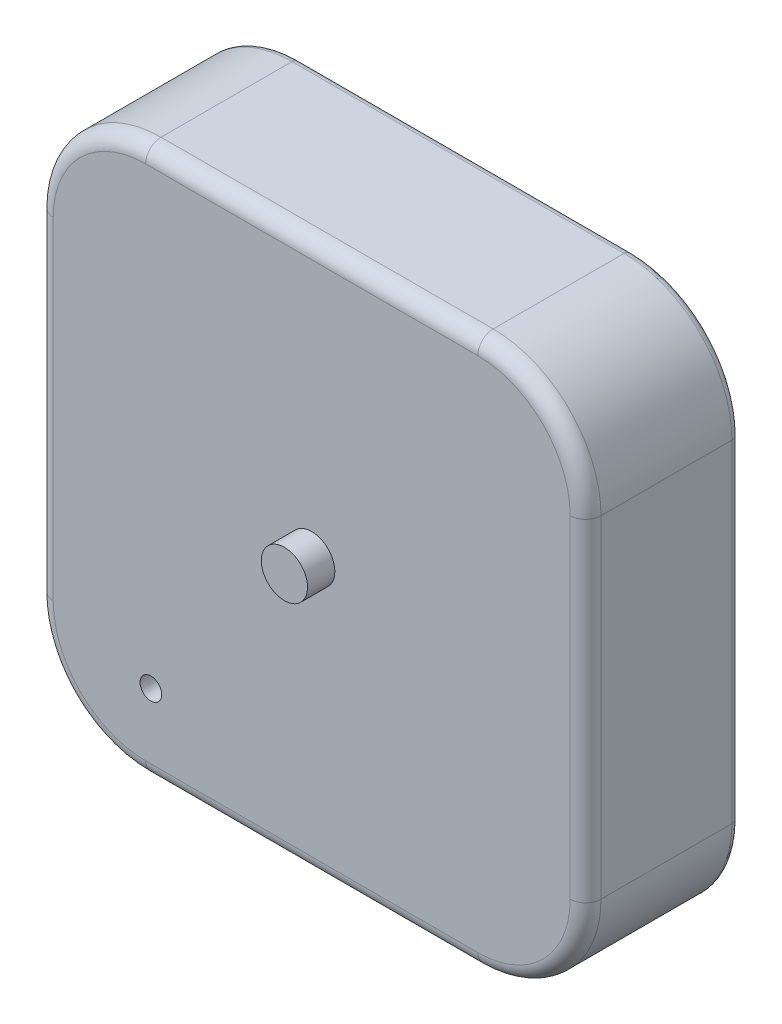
SolidWorks part; units mm, degrees
ref_plane "Front Plane" through (0, 0, 0) normal (0, 0, 1) x (1, 0, 0)
ref_plane "Top Plane" through (0, 0, 0) normal (0, 1, 0) x (1, 0, 0)
ref_plane "Right Plane" through (0, 0, 0) normal (1, 0, 0) x (0, 0, -1)
sketch "Sketch1" plane through (0, 0, 0) normal (0, 0, 1) x (1, 0, 0)
  line L1 (-177.8, 177.8) -> (177.8, 177.8)
  line L2 (-177.8, 177.8) -> (-177.8, -177.8)
  line L3 (-177.8, -177.8) -> (177.8, -177.8)
  line L4 (177.8, 177.8) -> (177.8, -177.8)
  line L5 (-177.8, 177.8) -> (177.8, -177.8) construction
  line L6 (-177.8, -177.8) -> (177.8, 177.8) construction
  point P0 (0, 0)
  dimension "D1" = 355.6
  dimension "D2" = 355.6
extrude "Boss-Extrude1" add sketch "Sketch1" along normal blind 100
fillet "Fillet1" radius 70 4 edges at (177.8, 177.8, 50) (177.8, -177.8, 50) (-177.8, -177.8, 50) (-177.8, 177.8, 50)
sketch "Sketch2" plane through (0, 0, 100) normal (0, 0, 1) x (1, 0, 0)
  line L0 (-177.8, 107.8) -> (-177.8, -107.8) construction
  line L1 (-107.8, -177.8) -> (107.8, -177.8) construction
  circle A0 centre (-104.42, -125.46) radius 7.03
  dimension "D1" = 14.06
  dimension "D2" = 73.38
  dimension "D3" = 52.34
extrude "Cut-Extrude1" cut sketch "Sketch2" against normal blind 25.04
fillet "Fillet3" radius 5 8 edges at (-157.2975, -157.2975, 0) (-177.8, 0, 0) (-157.2975, 157.2975, 0) (0, 177.8, 0) (157.2975, 157.2975, 0) (177.8, 0, 0) (157.2975, -157.2975, 0) (0, -177.8, 0)
fillet "Fillet4" radius 10 8 edges at (-157.2975, -157.2975, 100) (-177.8, 0, 100) (-157.2975, 157.2975, 100) (0, 177.8, 100) (157.2975, 157.2975, 100) (177.8, 0, 100) (157.2975, -157.2975, 100) (0, -177.8, 100)
sketch "Sketch3" plane through (0, 0, 100) normal (0, 0, 1) x (1, 0, 0)
  circle A0 centre (0, 0) radius 15
  dimension "D1" = 30
extrude "Boss-Extrude2" add sketch "Sketch3" along normal blind 17.7
